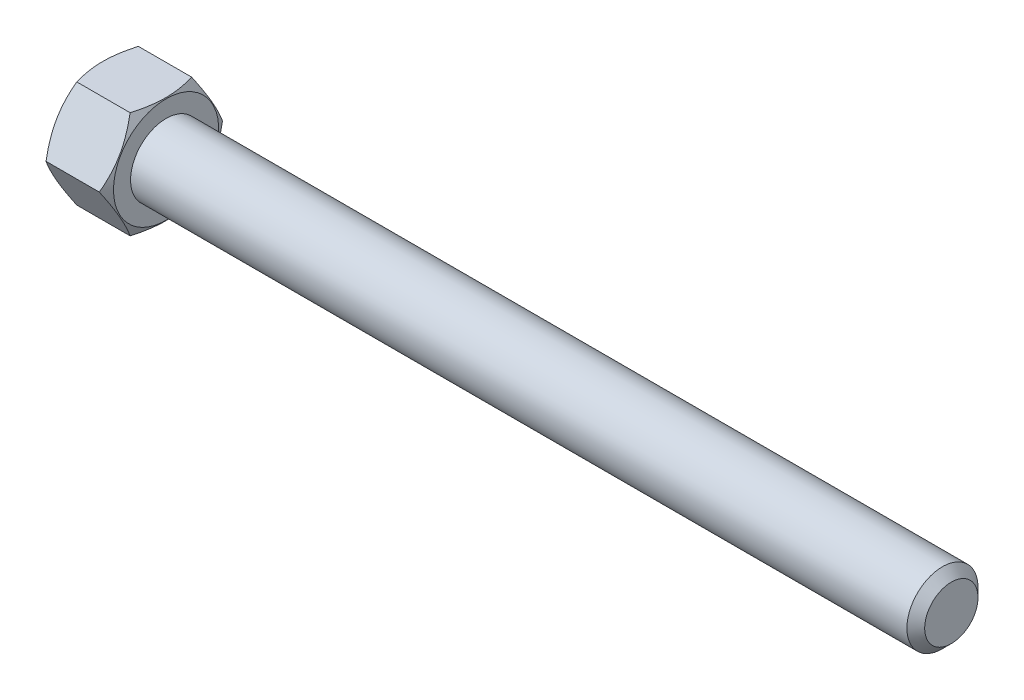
SolidWorks part; units mm, degrees
ref_plane "Face" through (0, 0, 0) normal (0, 0, 1) x (1, 0, 0)
ref_plane "Dessus" through (0, 0, 0) normal (0, 1, 0) x (1, 0, 0)
ref_plane "Droite" through (0, 0, 0) normal (1, 0, 0) x (0, 0, -1)
sketch "Esquisse1" plane through (0, 0, 0) normal (0, 0, 1) x (1, 0, 0)
  line L0 (0, 0) -> (369.3592, 0) construction
  line L1 (0, 0) -> (0, 12)
  line L4 (0, 12) -> (286.5, 12)
  line L5 (286.5, 12) -> (286.5, 0)
  line L6 (0, 0) -> (286.5, 0)
  dimension "D2" = 24
  dimension "D4" = 286.5
revolve "Révolution1" add sketch "Esquisse1" angle 360 about L0
chamfer "Chanfrein1" distance 3 angle 45 1 edges at (286.5, 0, 12)
sketch "Esquisse5" plane through (0, 0, 0) normal (-1, 0, 0) x (0, 0, 1)
  line L1 (20.7846, 0) -> (10.3923, 18)
  line L2 (10.3923, 18) -> (-10.3923, 18)
  line L3 (-10.3923, 18) -> (-20.7846, 0)
  line L4 (-20.7846, 0) -> (-10.3923, -18)
  line L5 (-10.3923, -18) -> (10.3923, -18)
  line L6 (10.3923, -18) -> (20.7846, 0)
  circle A0 centre (0, 0) radius 18 construction
  dimension "D1" = 36
extrude "Extrusion2" add sketch "Esquisse5" against normal blind 21.5 separate body
sketch "Esquisse7" plane through (0, 0, 0) normal (0, 1, 0) x (1, 0, 0)
  line L0 (1.75, 20.7846) -> (0, 17.7535)
  line L2 (21.5, 20.7846) -> (0, 20.7846) construction
  line L4 (0, 10.3923) -> (0, 20.7846) construction
  line L5 (0, 17.7535) -> (0, 20.7846)
  line L7 (0, 20.7846) -> (1.75, 20.7846)
  line L8 (21.5, 17.7535) -> (19.75, 20.7846)
  line L9 (21.5, 10.3923) -> (21.5, 20.7846) construction
  line L10 (19.75, 20.7846) -> (21.5, 20.7846)
  line L11 (21.5, 20.7846) -> (21.5, 17.7535)
  dimension "D1" = 30
  dimension "D2" = 1.75
  dimension "D3" = 30
  dimension "D4" = 1.75
revolve "Enlèvement de matière-Révolution3" cut sketch "Esquisse7" angle 360 about axis through (0, 0, 0) along (1, 0, 0)
sketch "Esquisse12" plane through (0, 0, 0) normal (-1, 0, 0) x (0, 0, 1)
  circle A0 centre (0, 0) radius 10.5
  dimension "D1" = 21
extrude "Enlèv. mat.-Extru.1" cut sketch "Esquisse12" against normal through all
